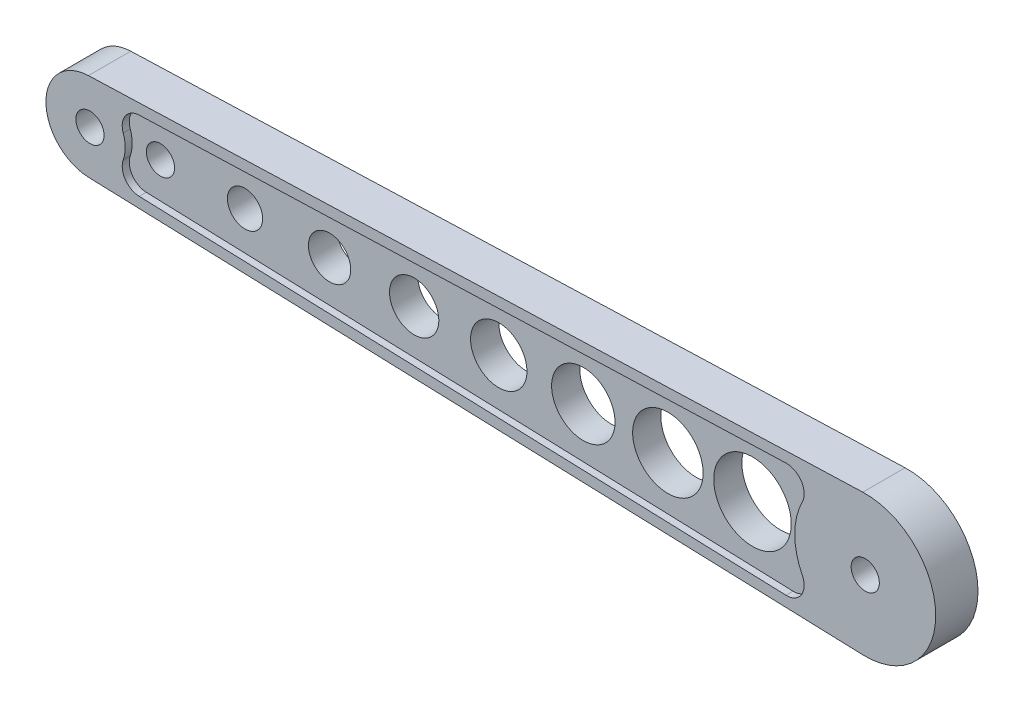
SolidWorks part; units mm, degrees
ref_plane "Ön Düzlem" through (0, 0, 0) normal (0, 0, 1) x (1, 0, 0)
ref_plane "Üst Düzlem" through (0, 0, 0) normal (0, 1, 0) x (1, 0, 0)
ref_plane "Sağ Düzlem" through (0, 0, 0) normal (1, 0, 0) x (0, 0, -1)
sketch "Çizim1" plane through (0, 0, 0) normal (0, 0, 1) x (1, 0, 0)
  line L1 (-220.4261, 12.4927) -> (-0.6818, 19.9884)
  line L2 (-220.4261, -12.4927) -> (-0.6818, -19.9884)
  arc A0 (-0.6818, -19.9884) -> (-0.6818, 19.9884) centre (0, 0) ccw
  arc A1 (-220.4261, 12.4927) -> (-220.4261, -12.4927) centre (-220, 0) ccw
  circle A2 centre (-220, 0) radius 4
  circle A3 centre (0, 0) radius 4
  dimension "D1" = 220
  dimension "D2" = 25
  dimension "D3" = 40
  dimension "D4" = 8
  dimension "D5" = 8
extrude "Yükseklik-Ekstrüzyon1" add sketch "Çizim1" along normal blind 12
sketch "Çizim2" plane through (0, 0, 12) normal (0, 0, 1) x (1, 0, 0)
  line L4 (-220.3239, -9.4945) -> (-0.5795, -16.9901)
  line L5 (-0.5795, 16.9901) -> (-220.3239, 9.4945)
  line L6 (-217.2032, -9.6009) -> (-11.1091, -16.6309)
  line L7 (-11.1091, 16.6309) -> (-217.2032, 9.6009)
  arc A4 (-220.3239, 9.4945) -> (-220.3239, -9.4945) centre (-220, 0) ccw
  arc A5 (-0.5795, -16.9901) -> (-0.5795, 16.9901) centre (0, 0) ccw
  circle A11 centre (-220, 0) radius 9
  arc A12 (-217.2032, -9.6009) -> (-217.2032, 9.6009) centre (-220, 0) ccw
  circle A14 centre (0, 0) radius 19
  arc A15 (-11.1091, 16.6309) -> (-11.1091, -16.6309) centre (0, 0) ccw
  dimension "D1" = 3
  dimension "D2" = 5
  dimension "D3" = 15
extrude "Kes-Ekstrüzyon1" cut sketch "Çizim2" against normal blind 2
ref_plane "Düzlem1" through (0, 0, 10) normal (0, 0, 1) x (1, 0, 0)
fillet "Radyus2" radius 5 4 edges at (-11.1091, -16.6309, 11) (-11.1091, 16.6309, 11) (-217.2032, -9.6009, 11) (-217.2032, 9.6009, 11)
ref_plane "Düzlem2" through (0, 0, 6) normal (0, 0, 1) x (1, 0, 0)
mirror "Aynalama2" about plane through (0, 0, 6) normal (0, 0, 1) of "Kes-Ekstrüzyon1"
fillet "Radyus3" radius 5 4 edges at (-217.2032, -9.6009, 1) (-217.2032, 9.6009, 1) (-11.1091, -16.6309, 1) (-11.1091, 16.6309, 1)
sketch "Çizim3" plane through (0, 0, 10) normal (0, 0, 1) x (1, 0, 0)
  circle A0 centre (-202, 0) radius 4
  circle A1 centre (-178, 0) radius 5
  circle A2 centre (-154, 0) radius 6
  circle A3 centre (-130, 0) radius 7
  circle A4 centre (-106, 0) radius 8
  circle A5 centre (-82, 0) radius 9
  circle A6 centre (-58, 0) radius 10
  circle A7 centre (-34, 0) radius 11
  arc A8 (-210.5684, -3.3235) -> (-210.5684, 3.3235) centre (-220, 0) ccw construction
  dimension "D1" = 24
  dimension "D7" = 24
  dimension "D2" = 24
  dimension "D3" = 24
  dimension "D4" = 24
  dimension "D5" = 24
  dimension "D6" = 24
  dimension "D8" = 18
extrude "Kes-Ekstrüzyon3" cut sketch "Çizim3" against normal blind 10
